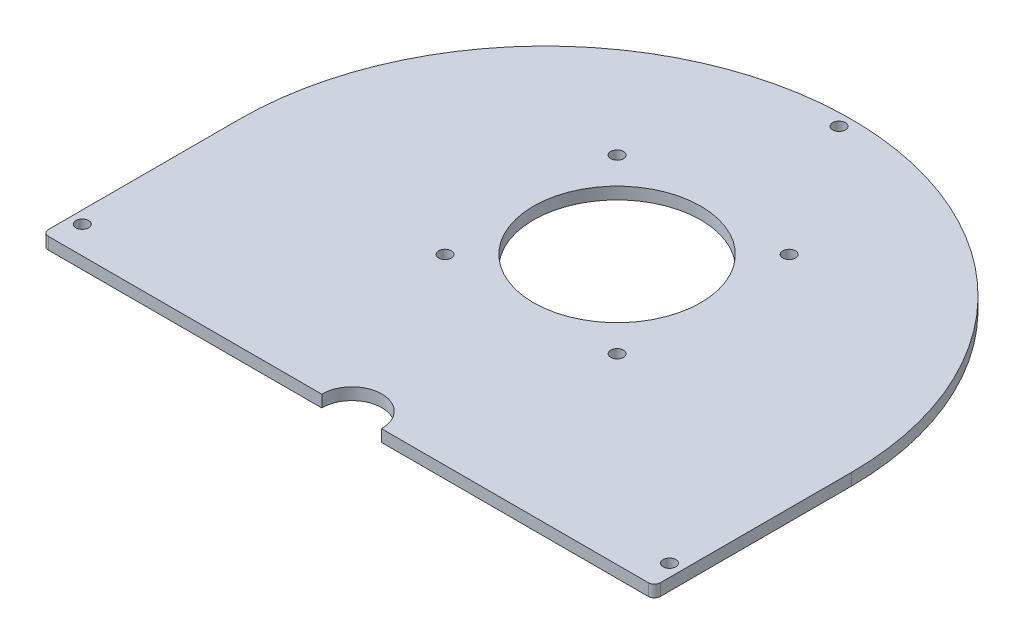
SolidWorks part; units mm, degrees
ref_plane "Front Plane" through (0, 0, 0) normal (0, 0, 1) x (1, 0, 0)
ref_plane "Top Plane" through (0, 0, 0) normal (0, 1, 0) x (1, 0, 0)
ref_plane "Right Plane" through (0, 0, 0) normal (1, 0, 0) x (0, 0, -1)
sketch "Sketch1" plane through (0, 0, 0) normal (0, 1, 0) x (1, 0, 0)
  line L0 (0, -246.6688) -> (0, 277.9383) construction
  line L1 (-246.6688, 0) -> (246.6688, 0) construction
  line L2 (-246.6688, -90.0684) -> (252.0096, -90.0684) construction
  line L3 (-246.6688, 156.0068) -> (246.6688, 156.0068) construction
  line L4 (-156.0068, -16.7747) -> (-156.0068, -96.1054) construction
  line L5 (-162.56, -104.6734) -> (162.56, -104.6734)
  line L6 (-162.56, -104.6734) -> (-162.56, 0)
  line L8 (162.56, -104.6734) -> (162.56, 0)
  line L11 (156.0068, -16.7747) -> (156.0068, -96.1054) construction
  arc A0 (162.56, 0) -> (-162.56, 0) centre (0, 0) ccw
  point P13 (0, 77.6209)
  dimension "D2" = 156.0068
  dimension "D3" = 162.56
  dimension "D5" = 156.0068
  dimension "D6" = 14.605
extrude "Boss-Extrude1" add sketch "Sketch1" along normal blind 6.35
hole_wizard "1/4 Clearance Hole1" positions "Sketch4" profile "Sketch5" hole size "1/4" standard "ANSI Inch"
sketch "Sketch4" plane through (0, 6.35, 0) normal (0, 1, 0) x (1, 0, 0)
  line L3 (0, -104.6734) -> (0, 162.56) construction
  line L4 (-162.56, -104.6734) -> (162.56, -104.6734) construction
  line L6 (-162.56, -90.0684) -> (162.56, -90.0684) construction
  line L7 (-162.56, 0) -> (-162.56, -104.6734) construction
  line L8 (162.56, -104.6734) -> (162.56, 0) construction
  line L10 (-162.56, 0) -> (162.56, 0) construction
  arc A1 (162.56, 0) -> (-162.56, 0) centre (0, 0) ccw construction
  point P0 (0, 156.0068)
  point P2 (-156.0068, -90.0684)
  point P4 (156.0068, -90.0684)
  dimension "D1" = 90.0684
  dimension "D2" = 156.0068
  dimension "D3" = 156.0068
  dimension "D4" = 246.0752
sketch "Sketch5" plane through (0, 6.35, -156.0068) normal (1, 0, 0) x (0, 0, 1)
  line L0 (0, 0) -> (0, 6.35)
  line L1 (0, 6.35) -> (3.3782, 6.35)
  line L2 (3.3782, 6.35) -> (3.3782, 0)
  line L5 (3.3782, 0) -> (0, 0)
  line L11 (0, -6.35) -> (0, 107.95) construction
  dimension "Thru Hole Dia." = 6.7564
  dimension "Thru Hole Depth" = 6.35
sketch "Sketch8" plane through (0, 6.35, 0) normal (0, 1, 0) x (1, 0, 0)
  circle A0 centre (0, 38.1) radius 44.45
  point P40 (0, 0)
  dimension "D1" = 38.1
  dimension "D4" = 88.9
extrude "Cut-Extrude1" cut sketch "Sketch8" against normal through all
fillet "Fillet1" radius 3.175 2 edges at (162.56, 3.175, 104.6734) (-162.56, 3.175, 104.6734)
hole_wizard "1/4 Clearance Hole2" positions "Sketch9" profile "Sketch10" hole size "1/4" standard "ANSI Inch"
sketch "Sketch9" plane through (0, 0, 0) normal (0, -1, 0) x (-1, 0, 0)
  circle A0 centre (0, 38.1) radius 44.45 construction
  point P0 (-45.72, 83.82)
  point P2 (45.72, 83.82)
  point P9 (45.72, -7.62)
  point P11 (-45.72, -7.62)
  dimension "D1" = 45.72
  dimension "D2" = 45.72
  dimension "D3" = 45.72
  dimension "D4" = 45.72
sketch "Sketch10" plane through (45.72, 0, -83.82) normal (1, 0, 0) x (0, 0, -1)
  line L0 (0, 0) -> (0, 6.35)
  line L1 (0, 6.35) -> (3.3782, 6.35)
  line L2 (3.3782, 6.35) -> (3.3782, 0)
  line L5 (3.3782, 0) -> (0, 0)
  line L11 (0, -6.35) -> (0, 107.95) construction
  dimension "Thru Hole Dia." = 6.7564
  dimension "Thru Hole Depth" = 6.35
sketch "Sketch11" plane through (0, 6.35, 0) normal (0, 1, 0) x (1, 0, 0)
  circle A0 centre (1.7125, -104.475) radius 26.9875 construction
  circle A1 centre (1.7125, -104.475) radius 26.9875 construction
  circle A2 centre (1.7125, -104.475) radius 15.875
  dimension "D1" = 31.75
extrude "Cut-Extrude2" cut sketch "Sketch11" against normal through all
